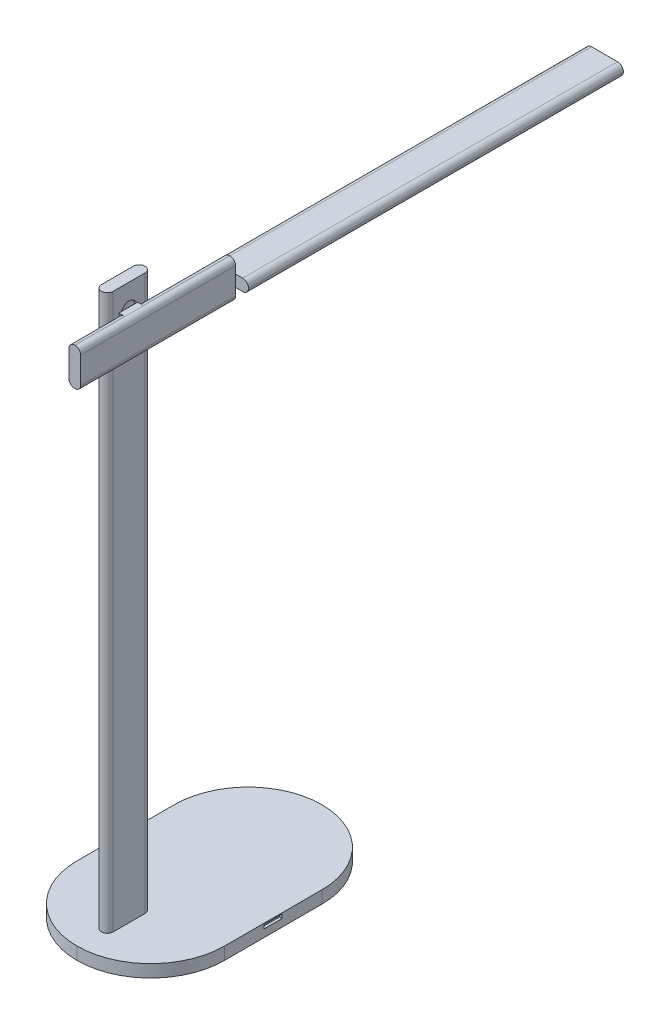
SolidWorks part; units mm, degrees
ref_plane "Alzado" through (0, 0, 0) normal (0, 0, 1) x (1, 0, 0)
ref_plane "Planta" through (0, 0, 0) normal (0, 1, 0) x (1, 0, 0)
ref_plane "Vista lateral" through (0, 0, 0) normal (1, 0, 0) x (0, 0, -1)
sketch "Croquis1" plane through (0, 0, 0) normal (0, 1, 0) x (1, 0, 0)
  line L1 (-59, -98) -> (59, -98)
  line L2 (-59, -98) -> (-59, 98)
  line L3 (-59, 98) -> (59, 98)
  line L4 (59, -98) -> (59, 98)
  line L5 (-59, -98) -> (59, 98) construction
  line L6 (-59, 98) -> (59, -98) construction
  point P0 (0, 0)
  dimension "D1" = 196
  dimension "D2" = 118
extrude "Saliente-Extruir1" add sketch "Croquis1" along normal blind 10
fillet "Redondeo1" radius 59 2 edges at (-59, 5, 98) (59, 5, 98)
fillet "Redondeo2" radius 59 2 edges at (-59, 5, -98) (59, 5, -98)
sketch "Croquis2" plane through (0, 10, 0) normal (0, 1, 0) x (1, 0, 0)
  line L0 (0, -73.7138) -> (0, -48.222) construction
  line L1 (-4.6735, -73.7138) -> (-4.6735, -48.222)
  line L2 (4.6735, -73.7138) -> (4.6735, -48.222)
  arc A0 (-4.6735, -73.7138) -> (4.6735, -73.7138) centre (0, -73.7138) ccw
  arc A1 (4.6735, -48.222) -> (-4.6735, -48.222) centre (0, -48.222) ccw
  point P2 (0, -60.9679)
extrude "Saliente-Extruir2" add sketch "Croquis2" along normal blind 444
sketch "Croquis3" plane through (59, 0, 0) normal (1, 0, 0) x (0, 0, -1)
  line L1 (-7.1581, 6.0553) -> (7.1581, 6.0553)
  line L2 (-7.1581, 6.0553) -> (-7.1581, 9.1527)
  line L3 (-7.1581, 9.1527) -> (7.1581, 9.1527)
  line L4 (7.1581, 6.0553) -> (7.1581, 9.1527)
  line L5 (-7.1581, 6.0553) -> (7.1581, 9.1527) construction
  line L6 (-7.1581, 9.1527) -> (7.1581, 6.0553) construction
  point P0 (0, 7.604)
extrude "Cortar-Extruir1" cut sketch "Croquis3" against normal blind 2
sketch "Croquis4" plane through (4.6735, 0, 0) normal (1, 0, 0) x (0, 0, -1)
  line L0 (-60.9679, 408.4686) -> (-60.9679, 434.8287) construction
  line L1 (-67.1659, 408.4686) -> (-67.1659, 434.8287)
  line L2 (-54.7699, 408.4686) -> (-54.7699, 434.8287)
  arc A0 (-67.1659, 408.4686) -> (-54.7699, 408.4686) centre (-60.9679, 408.4686) ccw
  arc A1 (-54.7699, 434.8287) -> (-67.1659, 434.8287) centre (-60.9679, 434.8287) ccw
  point P2 (-60.9679, 421.6486)
extrude "Cortar-Extruir2" cut sketch "Croquis4" against normal blind 2
sketch "Croquis5" plane through (4.6735, 0, 0) normal (1, 0, 0) x (0, 0, -1)
  line L2 (14.8986, 436.6486) -> (14.8986, 406.6486)
  line L3 (14.8986, 406.6486) -> (-109.1014, 406.6486)
  line L4 (-47.7878, 427.8466) -> (-74.148, 427.8466)
  line L5 (-74.148, 415.4507) -> (-47.7878, 415.4507)
  line L6 (-109.1014, 406.6486) -> (-109.1014, 436.6486)
  line L7 (14.8986, 436.6486) -> (-109.1014, 436.6486)
  arc A4 (-47.7878, 415.4507) -> (-47.7878, 427.8466) centre (-47.7878, 421.6486) ccw
  arc A5 (-74.148, 427.8466) -> (-74.148, 415.4507) centre (-74.148, 421.6486) ccw
extrude "Saliente-Extruir3" add sketch "Croquis5" along normal blind 9.35
sketch "Croquis6" plane through (14.0235, 0, 0) normal (1, 0, 0) x (0, 0, -1)
  line L0 (-47.7878, 427.8466) -> (-74.148, 427.8466) construction
  line L1 (-47.7878, 427.8466) -> (-74.148, 427.8466)
  line L2 (-74.148, 415.4507) -> (-47.7878, 415.4507) construction
  line L3 (-74.148, 415.4507) -> (-47.7878, 415.4507)
  arc A0 (-47.7878, 415.4507) -> (-47.7878, 427.8466) centre (-47.7878, 421.6486) ccw construction
  arc A1 (-47.7878, 415.4507) -> (-47.7878, 427.8466) centre (-47.7878, 421.6486) ccw
  arc A2 (-74.148, 427.8466) -> (-74.148, 415.4507) centre (-74.148, 421.6486) ccw construction
  arc A3 (-74.148, 427.8466) -> (-74.148, 415.4507) centre (-74.148, 421.6486) ccw
extrude "Saliente-Extruir4" add sketch "Croquis6" against normal blind 5
sketch "Croquis7" plane through (0, 0, -14.8986) normal (0, 0, -1) x (-1, 0, 0)
  line L1 (-24.3485, 426.3236) -> (5.6515, 426.3236)
  line L2 (-24.3485, 426.3236) -> (-24.3485, 416.9736)
  line L3 (-24.3485, 416.9736) -> (5.6515, 416.9736)
  line L4 (5.6515, 426.3236) -> (5.6515, 416.9736)
  line L5 (-24.3485, 426.3236) -> (5.6515, 416.9736) construction
  line L6 (-24.3485, 416.9736) -> (5.6515, 426.3236) construction
  point P0 (-9.3485, 421.6486)
  point P5 (0, 0)
  dimension "D1" = 30
  dimension "D2" = 9.35
extrude "Saliente-Extruir5" add sketch "Croquis7" along normal blind 300
sketch "Croquis9" plane through (0, 0, 109.1014) normal (0, 0, 1) x (1, 0, 0)
  line L0 (9.3485, 436.6486) -> (9.3485, 406.6486)
  line L9 (4.6735, 436.6486) -> (4.6735, 406.6486)
  line L10 (4.6735, 406.6486) -> (14.0235, 406.6486)
  line L11 (14.0235, 406.6486) -> (14.0235, 436.6486)
  line L12 (14.0235, 436.6486) -> (4.6735, 436.6486)
  line L13 (4.6735, 436.6486) -> (4.6735, 406.6486)
  line L14 (4.6735, 406.6486) -> (9.3485, 406.6486)
  line L16 (9.3485, 436.6486) -> (4.6735, 436.6486)
  dimension "D1" = 0
fillet "Redondeo8" radius 4.65 4 edges at (24.3485, 416.9736, -164.8986) (-5.6515, 416.9736, -164.8986) (-5.6515, 426.3236, -164.8986) (24.3485, 426.3236, -164.8986)
fillet "Redondeo9" radius 4.5 2 edges at (14.0235, 406.6486, 47.1014) (14.0235, 436.6486, 47.1014)
extrude "Cortar-Extruir8" cut sketch "Croquis9" against normal blind 40
sketch "Croquis10" plane through (0, 0, -14.8986) normal (0, 0, -1) x (-1, 0, 0)
  line L4 (-9.3485, 436.6486) -> (-9.3485, 406.6486)
  line L5 (-9.3485, 406.6486) -> (-4.6735, 406.6486)
  line L6 (-4.6735, 406.6486) -> (-4.6735, 436.6486)
  line L7 (-4.6735, 436.6486) -> (-9.3485, 436.6486)
  line L8 (-9.3485, 436.6486) -> (-9.3485, 406.6486)
  line L9 (-9.3485, 406.6486) -> (-4.6735, 406.6486)
  line L10 (-4.6735, 406.6486) -> (-4.6735, 436.6486)
  line L11 (-4.6735, 436.6486) -> (-9.3485, 436.6486)
  dimension "D1" = 0
extrude "Cortar-Extruir9" cut sketch "Croquis10" against normal blind 69
sketch "Croquis11" plane through (0, 0, 109.1014) normal (0, 0, 1) x (1, 0, 0)
  line L0 (4.6735, 411.1486) -> (4.6735, 432.1486)
  line L1 (9.1735, 436.6486) -> (9.3485, 436.6486)
  line L2 (9.1735, 406.6486) -> (9.3485, 406.6486)
  line L4 (9.5235, 436.6486) -> (9.3485, 436.6486)
  line L5 (9.3485, 436.6486) -> (9.3485, 406.6486)
  line L6 (9.3485, 406.6486) -> (9.5235, 406.6486)
  line L7 (14.0235, 411.1486) -> (14.0235, 432.1486)
  line L9 (9.3485, 436.6486) -> (9.3485, 406.6486)
  arc A0 (9.1735, 406.6486) -> (4.6735, 411.1486) centre (9.1735, 411.1486) cw
  arc A1 (4.6735, 432.1486) -> (9.1735, 436.6486) centre (9.1735, 432.1486) cw
  arc A2 (9.5235, 406.6486) -> (14.0235, 411.1486) centre (9.5235, 411.1486) ccw
  arc A3 (14.0235, 432.1486) -> (9.5235, 436.6486) centre (9.5235, 432.1486) ccw
  dimension "D1" = 0
extrude "Saliente-Extruir6" add sketch "Croquis11" against normal up to surface (40 mm away)
sketch "Croquis12" plane through (0, 0, 54.1014) normal (0, 0, -1) x (-1, 0, 0)
  line L4 (-4.6735, 411.1486) -> (-4.6735, 432.1486)
  line L5 (-9.1735, 436.6486) -> (-9.3485, 436.6486)
  line L6 (-9.3485, 436.6486) -> (-9.3485, 406.6486)
  line L7 (-9.3485, 406.6486) -> (-9.1735, 406.6486)
  line L8 (-4.6735, 411.1486) -> (-4.6735, 432.1486)
  line L9 (-9.1735, 436.6486) -> (-9.3485, 436.6486)
  line L10 (-9.3485, 436.6486) -> (-9.3485, 406.6486)
  line L11 (-9.3485, 406.6486) -> (-9.1735, 406.6486)
  arc A2 (-4.6735, 432.1486) -> (-9.1735, 436.6486) centre (-9.1735, 432.1486) ccw
  arc A3 (-9.1735, 406.6486) -> (-4.6735, 411.1486) centre (-9.1735, 411.1486) ccw
  arc A4 (-4.6735, 432.1486) -> (-9.1735, 436.6486) centre (-9.1735, 432.1486) ccw
  arc A5 (-9.1735, 406.6486) -> (-4.6735, 411.1486) centre (-9.1735, 411.1486) ccw
  dimension "D1" = 0
extrude "Saliente-Extruir7" add sketch "Croquis12" along normal blind 69
sketch "Croquis13" plane through (0, 416.9736, 0) normal (0, -1, 0) x (1, 0, 0)
  line L1 (18.697, -16.1435) -> (0, -16.1435)
  line L2 (18.697, -16.1435) -> (18.697, -313.6537)
  line L3 (18.697, -313.6537) -> (0, -313.6537)
  line L4 (0, -16.1435) -> (0, -313.6537)
  line L5 (18.697, -16.1435) -> (0, -313.6537) construction
  line L6 (18.697, -313.6537) -> (0, -16.1435) construction
  point P0 (9.3485, -164.8986)
extrude "Cortar-Extruir10" cut sketch "Croquis13" against normal blind 1
